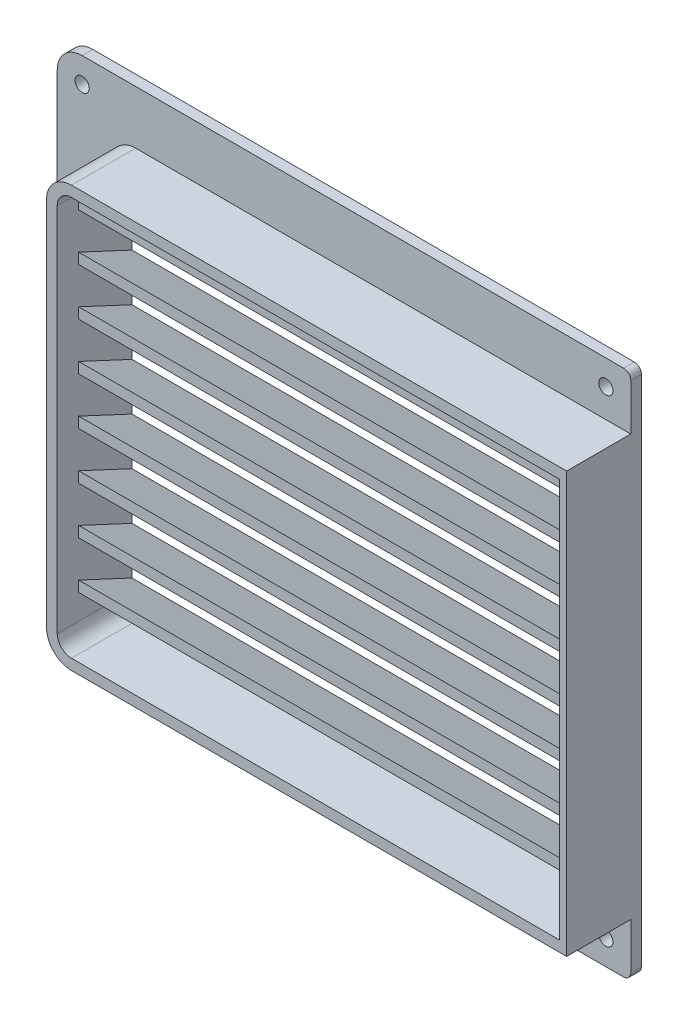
SolidWorks part; units mm, degrees
ref_plane "Спереди" through (0, 0, 0) normal (0, 0, 1) x (1, 0, 0)
ref_plane "Сверху" through (0, 0, 0) normal (0, 1, 0) x (1, 0, 0)
ref_plane "Справа" through (0, 0, 0) normal (1, 0, 0) x (0, 0, -1)
sketch "Эскиз1" plane through (0, 0, 0) normal (1, 0, 0) x (0, 0, -1)
  line L0 (0, 0) -> (0, 118) construction
  line L1 (0, 0) -> (-21, 0)
  line L2 (0, 0) -> (0, 3)
  line L3 (0, 3) -> (-21, 3)
  line L4 (-21, 0) -> (-21, 3)
  line L5 (0, 115) -> (-21, 115)
  line L6 (0, 115) -> (0, 118)
  line L7 (0, 118) -> (-21, 118)
  line L8 (-21, 115) -> (-21, 118)
  line L9 (0, 7) -> (-15, 13.9946)
  line L10 (-15, 13.9946) -> (-15, 16.9946)
  line L11 (-15, 16.9946) -> (0, 10)
  line L12 (0, 10) -> (0, 7)
  line L13 (-15, 27.2803) -> (-15, 30.2803)
  line L14 (-15, 30.2803) -> (0, 23.2857)
  line L15 (0, 23.2857) -> (0, 20.2857)
  line L16 (0, 20.2857) -> (-15, 27.2803)
  line L17 (-15, 40.566) -> (-15, 43.566)
  line L18 (-15, 43.566) -> (0, 36.5714)
  line L19 (0, 36.5714) -> (0, 33.5714)
  line L20 (0, 33.5714) -> (-15, 40.566)
  line L21 (-15, 53.8518) -> (-15, 56.8518)
  line L22 (-15, 56.8518) -> (0, 49.8571)
  line L23 (0, 49.8571) -> (0, 46.8571)
  line L24 (0, 46.8571) -> (-15, 53.8518)
  line L25 (-15, 67.1375) -> (-15, 70.1375)
  line L26 (-15, 70.1375) -> (0, 63.1429)
  line L27 (0, 63.1429) -> (0, 60.1429)
  line L28 (0, 60.1429) -> (-15, 67.1375)
  line L29 (-15, 80.4232) -> (-15, 83.4232)
  line L30 (-15, 83.4232) -> (0, 76.4286)
  line L31 (0, 76.4286) -> (0, 73.4286)
  line L32 (0, 73.4286) -> (-15, 80.4232)
  line L49 (-15, 93.7089) -> (-15, 96.7089)
  line L50 (-15, 96.7089) -> (0, 89.7143)
  line L51 (0, 89.7143) -> (0, 86.7143)
  line L52 (0, 86.7143) -> (-15, 93.7089)
  line L53 (-15, 106.9946) -> (-15, 109.9946)
  line L54 (-15, 109.9946) -> (0, 103)
  line L55 (0, 103) -> (0, 100)
  line L56 (0, 100) -> (-15, 106.9946)
  dimension "D2" = 118
  dimension "D3" = 3
  dimension "D4" = 21
  dimension "D5" = 4
  dimension "D6" = 12
  dimension "D7" = 15
  dimension "D8" = 65
  dimension "D9" = 3.2911
  dimension "D1" = 8
extrude "Бобышка-Вытянуть1" add sketch "Эскиз1" along normal blind 146
sketch "Эскиз2" plane through (0, 0, 0) normal (0, 0, -1) x (-1, 0, 0)
  line L0 (-146, 0) -> (0, 0) construction
  line L1 (-146, 118) -> (-144, 118)
  line L2 (-146, 118) -> (-146, 0)
  line L3 (-146, 0) -> (-144, 0)
  line L4 (-144, 118) -> (-144, 0)
  line L6 (0, 118) -> (-3, 118)
  line L7 (0, 118) -> (0, 0)
  line L8 (0, 0) -> (-3, 0)
  line L9 (-3, 118) -> (-3, 0)
  dimension "D1" = 2
  dimension "D2" = 3
extrude "Бобышка-Вытянуть2" add sketch "Эскиз2" against normal up to surface (21 mm away)
sketch "Эскиз3" plane through (0, 0, 0) normal (0, 0, -1) x (-1, 0, 0)
  line L0 (0, 59) -> (-146, 59) construction
  line L1 (-146, 0) -> (15, 0)
  line L2 (-146, 0) -> (-146, -15)
  line L3 (-146, -15) -> (15, -15)
  line L4 (15, 0) -> (15, -15)
  line L5 (0, 0) -> (0, 118) construction
  line L6 (-146, 0) -> (-146, 118) construction
  line L7 (-65.5, -15) -> (-65.5, 0) construction
  line L12 (15, 118) -> (15, 133)
  line L13 (-146, 133) -> (15, 133)
  line L14 (-146, 118) -> (-146, 133)
  line L15 (-146, 118) -> (15, 118)
  circle A2 centre (-139, -8) radius 2
  circle A3 centre (8, -8) radius 2
  circle A8 centre (8, 126) radius 2
  circle A9 centre (-139, 126) radius 2
extrude "Бобышка-Вытянуть3" add sketch "Эскиз3" against normal blind 3
sketch "Эскиз5" plane through (0, 0, 0) normal (0, 0, -1) x (-1, 0, 0)
  line L1 (15, 118) -> (0, 118)
  line L2 (15, 118) -> (15, 0)
  line L3 (15, 0) -> (0, 0)
  line L4 (0, 118) -> (0, 0)
extrude "Бобышка-Вытянуть4" add sketch "Эскиз5" against normal up to surface (3 mm away)
fillet "Скругление2" radius 7 2 edges at (0, 0, 12) (0, 118, 12)
fillet "Скругление3" radius 4 2 edges at (3, 3, 10.5) (3, 115, 10.5)
fillet "Скругление4" radius 2 2 edges at (146, -15, 1.5) (146, 133, 1.5)
fillet "Скругление5" radius 7 2 edges at (-15, -15, 1.5) (-15, 133, 1.5)
equation "\"D4@Эскиз3\"=\"D3@Эскиз3\""
equation "\"D6@Эскиз3\"=\"D1@Эскиз3\""
